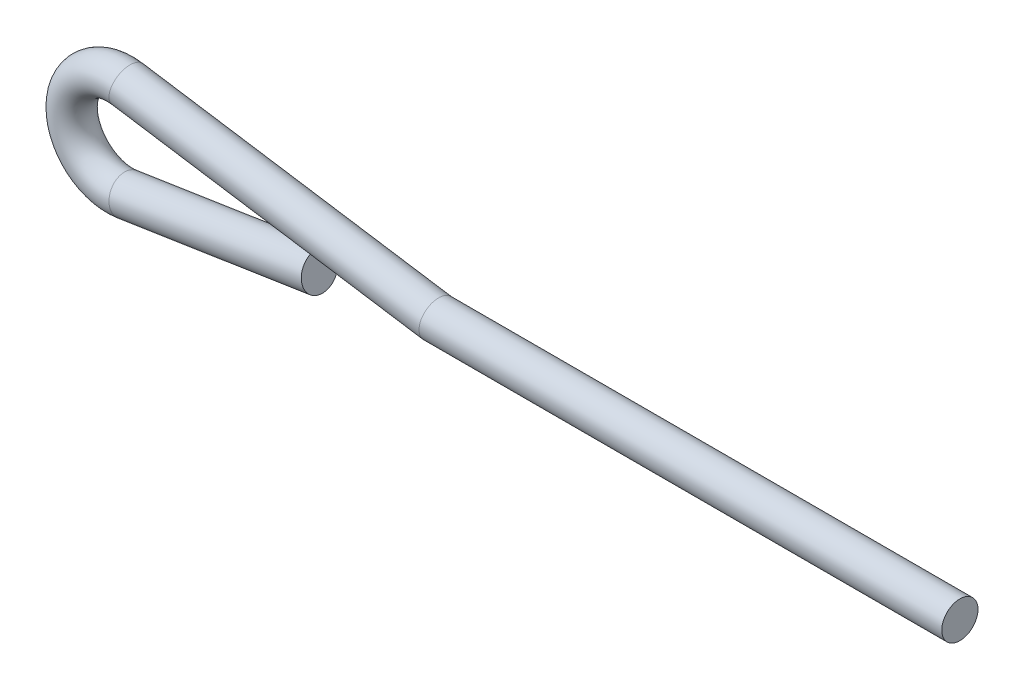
SolidWorks part; units mm, degrees
ref_plane "Front" through (0, 0, 0) normal (0, 0, 1) x (1, 0, 0)
ref_plane "Top" through (0, 0, 0) normal (0, 1, 0) x (1, 0, 0)
ref_plane "Right" through (0, 0, 0) normal (1, 0, 0) x (0, 0, -1)
sketch "Sketch2" plane through (-83.6956, -114.5384, 0) normal (0, 0, 1) x (0, 1, 0)
  line L0 (114.5384, -17.4214) -> (114.5384, -154.4214) construction
  line L1 (114.5384, -361.6956) -> (114.5384, -48.2156) construction
  line L2 (70.4012, -83.6956) -> (189.5185, -83.6956) construction
  line L3 (108.5384, -3.9296) -> (108.5384, -158.1438) construction
  line L4 (120.5384, -3.9296) -> (120.5384, -149.7804) construction
  line L5 (114.5384, -188.6956) -> (130.3516, -86.1337)
  line L6 (114.5384, -188.6956) -> (114.5384, -361.6956)
  line L7 (108.5384, -149.7804) -> (98.7253, -86.1337)
  arc A0 (130.3516, -86.1337) -> (98.7253, -86.1337) centre (114.5384, -83.6956) ccw
  circle A1 centre (114.5384, -83.6956) radius 10 construction
  arc A2 (92.5384, -83.6956) -> (136.5384, -83.6956) centre (114.5384, -83.6956) cw construction
  point P19 (120.5384, -149.7804)
  dimension "D4" = 22
  dimension "D3" = 16
  dimension "D" = 20
  dimension "d1" = 12
  dimension "d2" = 6
  dimension "h" = 127
  dimension "l" = 300
ref_plane "Plane1" through (66.0848, -6, 0) normal (-0.9883, -0.1524, 0) x (0, 0, 1)
sketch "Sketch1" plane through (66.0848, -6, 0) normal (-0.9883, -0.1524, 0) x (0, 0, 1)
  circle A0 centre (0, 0) radius 6
  dimension "d" = 12
sweep "BaseBody" add profiles "Sketch1" path "Sketch2"
sketch "Sketch3" plane through (0, 0, 0) normal (0, 0, 1) x (1, 0, 0)
  line L0 (277.5265, 6.947) -> (278.4735, 6.947)
  line L1 (278.4735, 6.947) -> (278.4735, 6)
  line L2 (278.4735, 6) -> (278, 5.1799)
  line L3 (278, 5.1799) -> (277.5265, 6)
  line L4 (277.5265, 6) -> (277.5265, 6.947)
  line L5 (278, -6) -> (278, 6) construction
  line L6 (278, 6) -> (105.4598, 6) construction
  dimension "D1" = 0.947
revolve "Cut-Revolve10" [suppressed] cut sketch "Sketch3" angle 360
pattern_linear "LPattern10" [suppressed] count 28
equation "\"d1@Sketch2\" =\"d@Sketch1\""
equation "\"d2@Sketch2\" =\"d@Sketch1\"/ 2"
equation "\"D3@Sketch2\" =  ( \"D@Sketch2\" +\"d@Sketch1\" )  / 2"
equation "\"D4@Sketch2\" = \"D3@Sketch2\" + \"d@Sketch1\" / 2"
equation "\"D1@Sketch3\" =  ( \"d@Sketch1\" - \"d1@ThreadCosmetic1\" )  / 2"
equation "\"pitch@LPattern10\" = 1.5 * \"D1@Sketch3\""
equation "\"D1@LPattern10\" = \"b@ThreadCosmetic1\" / \"pitch@LPattern10\""
